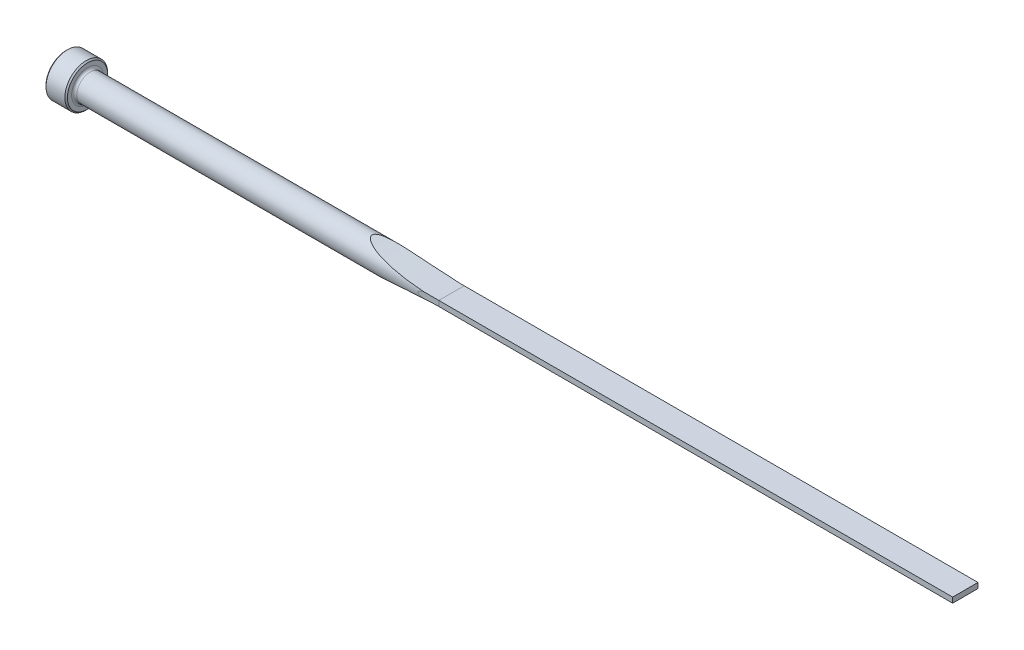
SolidWorks part; units mm, degrees
ref_plane "Front Plane" through (0, 0, 0) normal (0, 0, 1) x (1, 0, 0)
ref_plane "Top Plane" through (0, 0, 0) normal (0, 1, 0) x (1, 0, 0)
ref_plane "Right Plane" through (0, 0, 0) normal (1, 0, 0) x (0, 0, -1)
sketch "Sketch1" plane through (0, 0, 0) normal (0, 0, 1) x (1, 0, 0)
  line L0 (0, 0) -> (175.5286, 0) construction
  line L1 (0, 0) -> (0, 6.35)
  line L2 (0, 6.35) -> (6.35, 6.35)
  line L3 (6.35, 6.35) -> (6.35, 3.9624)
  line L4 (6.35, 3.9624) -> (266.7, 3.9624)
  line L5 (266.7, 3.9624) -> (266.7, 0)
  line L6 (266.7, 0) -> (0, 0)
  dimension "D1" = 266.7
  dimension "D2" = 12.7
  dimension "D3" = 7.9248
  dimension "D4" = 6.35
revolve "Revolve1" add sketch "Sketch1" angle 360 about L0
sketch "Sketch2" plane through (0, 0, 0) normal (0, 0, 1) x (1, 0, 0)
  line L0 (266.7, 3.9624) -> (266.7, 0.7874)
  line L1 (266.7, -3.9624) -> (266.7, 3.9624) construction
  line L2 (266.7, 0.7874) -> (114.3, 0.7874)
  line L3 (266.7, 3.9624) -> (6.35, 3.9624) construction
  line L4 (90.7536, 3.9624) -> (266.7, 3.9624)
  line L5 (166.0833, 0) -> (153.1705, 0) construction
  arc A0 (114.3, 0.7874) -> (90.7536, 3.9624) centre (114.3, 89.6874) cw
  dimension "D1" = 88.9
  dimension "D3" = 152.4
  dimension "D2" = 1.5748
  dimension "D4" = 23.5464
extrude "Cut-Extrude1" cut sketch "Sketch2" against normal through all both and the other way through all
mirror "Mirror1" about plane through (0, 0, 0) normal (0, 1, 0) of "Cut-Extrude1"
sketch "Sketch3" plane through (0, 0, 0) normal (0, 1, 0) x (1, 0, 0)
  line L0 (266.7, 3.9624) -> (266.7, 3.7592)
  line L1 (266.7, 3.8834) -> (266.7, -3.8834) construction
  line L2 (266.7, 3.7592) -> (114.3, 3.7592)
  line L3 (266.7, 3.9624) -> (6.35, 3.9624) construction
  line L4 (108.2927, 3.9624) -> (266.7, 3.9624)
  line L5 (163.4716, 0) -> (166.2513, 0) construction
  line L6 (114.3, 3.8834) -> (114.3, -3.8834) construction
  arc A0 (114.3, 3.7592) -> (108.2927, 3.9624) centre (114.3, 92.6592) cw
  dimension "D2" = 88.9
  dimension "D1" = 7.5184
extrude "Cut-Extrude2" cut sketch "Sketch3" against normal through all both and the other way through all
mirror "Mirror2" about plane through (0, 0, 0) normal (0, 0, 1) of "Cut-Extrude2"
fillet "Fillet1" radius 0.762 1 edges at (6.35, 0, 3.9624)
chamfer "Chamfer1" distance 0.381 angle 45 2 edges at (0, 0, 6.35) (6.35, 0, 6.35)
